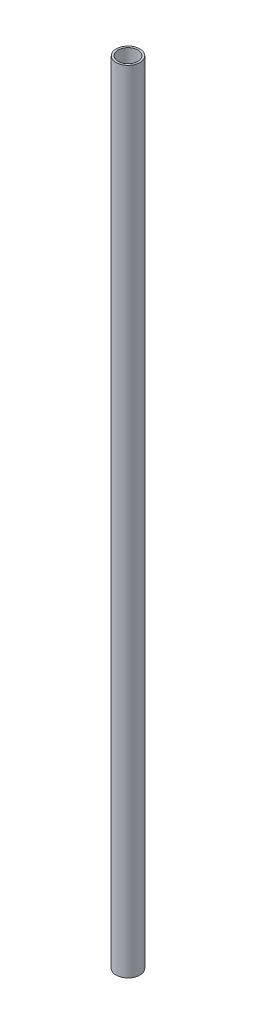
SolidWorks part; units mm, degrees
ref_plane "Plan de face" through (0, 0, 0) normal (0, 0, 1) x (1, 0, 0)
ref_plane "Plan de dessus" through (0, 0, 0) normal (0, 1, 0) x (1, 0, 0)
ref_plane "Plan de droite" through (0, 0, 0) normal (1, 0, 0) x (0, 0, -1)
sketch "Esquisse1" plane through (0, 0, 0) normal (0, 1, 0) x (1, 0, 0)
  circle A0 centre (0, 0) radius 6
  circle A1 centre (0, 0) radius 5
  dimension "D1" = 12
  dimension "D2" = 10
extrude "Extrusion1" add sketch "Esquisse1" along normal blind 400
